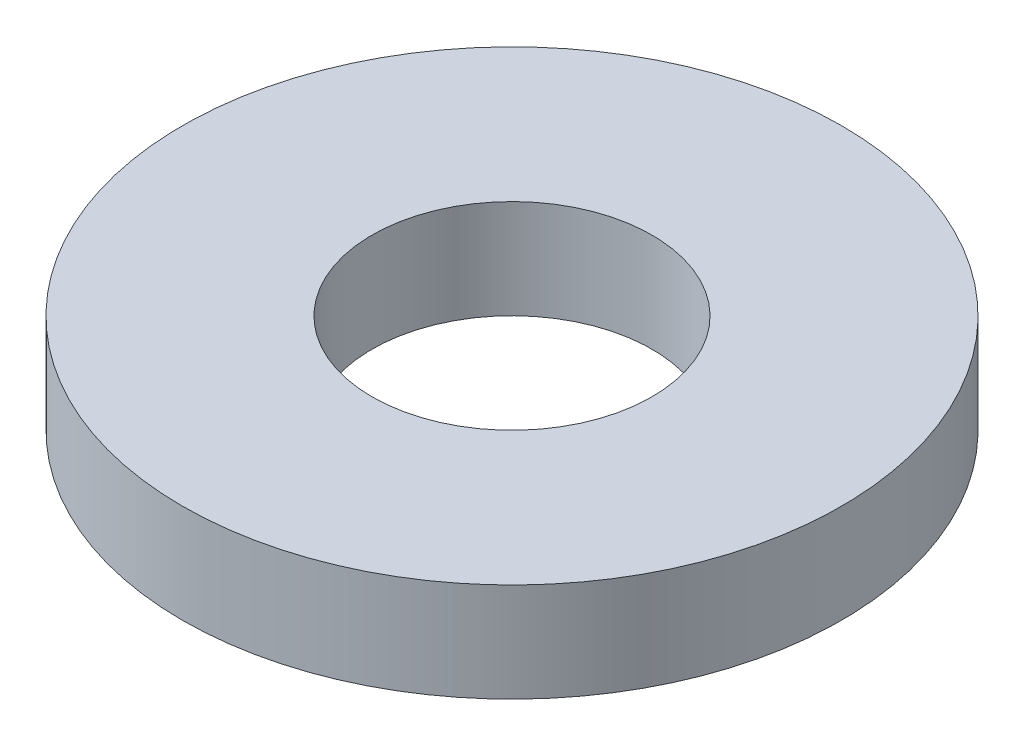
SolidWorks part; units mm, degrees
ref_plane "Face" through (0, 0, 0) normal (0, 0, 1) x (1, 0, 0)
ref_plane "Dessus" through (0, 0, 0) normal (0, 1, 0) x (1, 0, 0)
ref_plane "Droite" through (0, 0, 0) normal (1, 0, 0) x (0, 0, -1)
sketch "Esquisse1" plane through (0, 0, 0) normal (0, 1, 0) x (1, 0, 0)
  circle A0 centre (0, 0) radius 20
  circle A1 centre (0, 0) radius 8.5
  dimension "D1" = 40
  dimension "D2" = 17
extrude "Base-Extrusion" add sketch "Esquisse1" along normal blind 6
